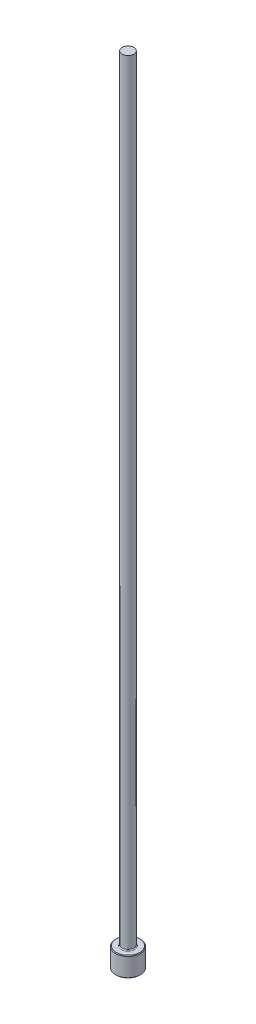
SolidWorks part; units mm, degrees
ref_plane "Front Plane" through (0, 0, 0) normal (0, 0, 1) x (1, 0, 0)
ref_plane "Top Plane" through (0, 0, 0) normal (0, 1, 0) x (1, 0, 0)
ref_plane "Right Plane" through (0, 0, 0) normal (1, 0, 0) x (0, 0, -1)
other "Configuration Table"
sketch "Sketch1" plane through (0, 0, 0) normal (0, 0, 1) x (1, 0, 0)
  line L0 (0, 259.9588) -> (0, -15.1925) construction
  line L1 (0, 0) -> (-0.9906, 0)
  line L2 (-0.9906, 0) -> (-0.9906, 1.5748)
  line L3 (-0.9906, 1.5748) -> (-0.4699, 1.5748)
  line L4 (-0.4699, 1.5748) -> (-0.4699, 63.5)
  line L5 (-0.4699, 63.5) -> (0, 63.5)
  line L6 (0, 63.5) -> (0, 0)
  dimension "L" = 63.5
  dimension "H" = 1.9812
  dimension "T" = 1.5748
  dimension "D" = 0.9398
revolve "Revolve1" add sketch "Sketch1" angle 360 about L0
chamfer "Chamfer1" distance 0.0508 angle 45 2 edges at (0, 1.5748, 0.9906) (0, 0, 0.9906)
fillet "Fillet1" radius 0.0762 1 edges at (0, 1.5748, 0.4699)
